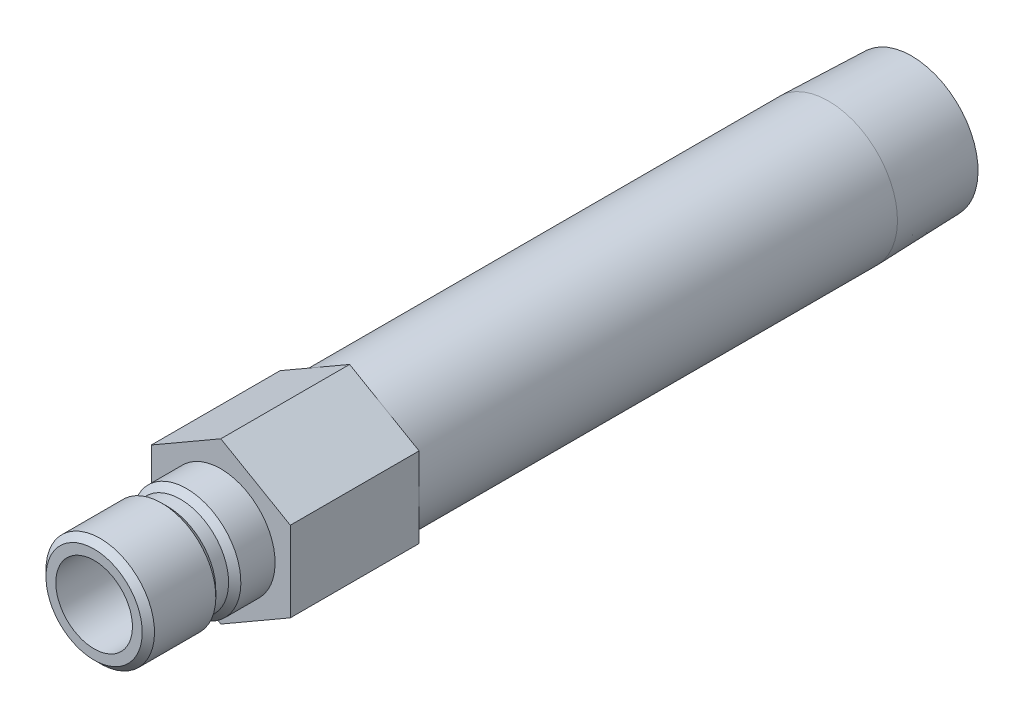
SolidWorks part; units mm, degrees
ref_plane "Front Plane" through (0, 0, 0) normal (0, 0, 1) x (1, 0, 0)
ref_plane "Top Plane" through (0, 0, 0) normal (0, 1, 0) x (1, 0, 0)
ref_plane "Right Plane" through (0, 0, 0) normal (1, 0, 0) x (0, 0, -1)
sketch "Sketch1" plane through (0, 0, 0) normal (1, 0, 0) x (0, 0, -1)
  line L0 (0, 0) -> (-18.923, 0) construction
  line L1 (-15.748, 4.7625) -> (-15.748, 5.9817)
  line L2 (-6.604, 5.9817) -> (-6.604, 0) construction
  line L3 (-14.986, 6.7437) -> (-7.366, 6.7437)
  line L4 (0, 8.5725) -> (0, 0) construction
  line L5 (-6.604, 5.9817) -> (-5.0165, 5.9817)
  line L6 (-4.2545, 6.7437) -> (0, 6.7437)
  line L7 (0, 6.7437) -> (0, 8.5725)
  line L8 (-6.604, 5.9817) -> (-7.366, 6.7437)
  line L9 (-5.0165, 5.9817) -> (-4.2545, 6.7437)
  line L10 (-15.748, 5.9817) -> (-14.986, 6.7437)
  line L11 (-15.748, 4.7625) -> (16.002, 4.7625)
  line L12 (0, 8.5725) -> (75.5142, 8.5725)
  line L13 (75.5142, 8.5725) -> (85.852, 8.2494)
  line L14 (85.852, 8.2494) -> (85.852, 6.2611)
  line L15 (0, 6.7437) -> (16.002, 6.7437) construction
  line L16 (16.002, 6.7437) -> (16.002, 0) construction
  line L17 (16.002, 0) -> (0, 0) construction
  line L18 (16.002, 4.7625) -> (16.002, 6.2611)
  line L19 (16.002, 6.2611) -> (85.852, 6.2611)
  dimension "D1" = 15.748
  dimension "D2" = 1.5875
  dimension "D3" = 0.762
  dimension "D4" = 45
  dimension "D5" = 9.144
  dimension "D6" = 45
  dimension "D7" = 1.79
  dimension "D8" = 10.3378
  dimension "D9" = 101.6
  dimension "D10" = 3.175
  dimension "D11" = 9.525
  dimension "D12" = 17.145
  dimension "D13" = 31.75
  dimension "D14" = 13.4874
  dimension "D15" = 12.5222
revolve "Revolve1" add sketch "Sketch1" angle 360 about L0
sketch "Sketch2" plane through (0, 0, 0) normal (0, 0, 1) x (1, 0, 0)
  line L1 (-8.636, 4.986) -> (-8.636, -4.986)
  line L2 (-8.636, -4.986) -> (0, -9.972)
  line L3 (0, -9.972) -> (8.636, -4.986)
  line L4 (8.636, -4.986) -> (8.636, 4.986)
  line L5 (8.636, 4.986) -> (0, 9.972)
  line L6 (0, 9.972) -> (-8.636, 4.986)
  circle A0 centre (0, 0) radius 8.636 construction
  circle A1 centre (0, 0) radius 4.7625 construction
  circle A2 centre (0, 0) radius 4.7625
  dimension "D1" = 17.272
extrude "Boss-Extrude1" add sketch "Sketch2" against normal up to vertex (16.002 mm away) from vertex at 0
